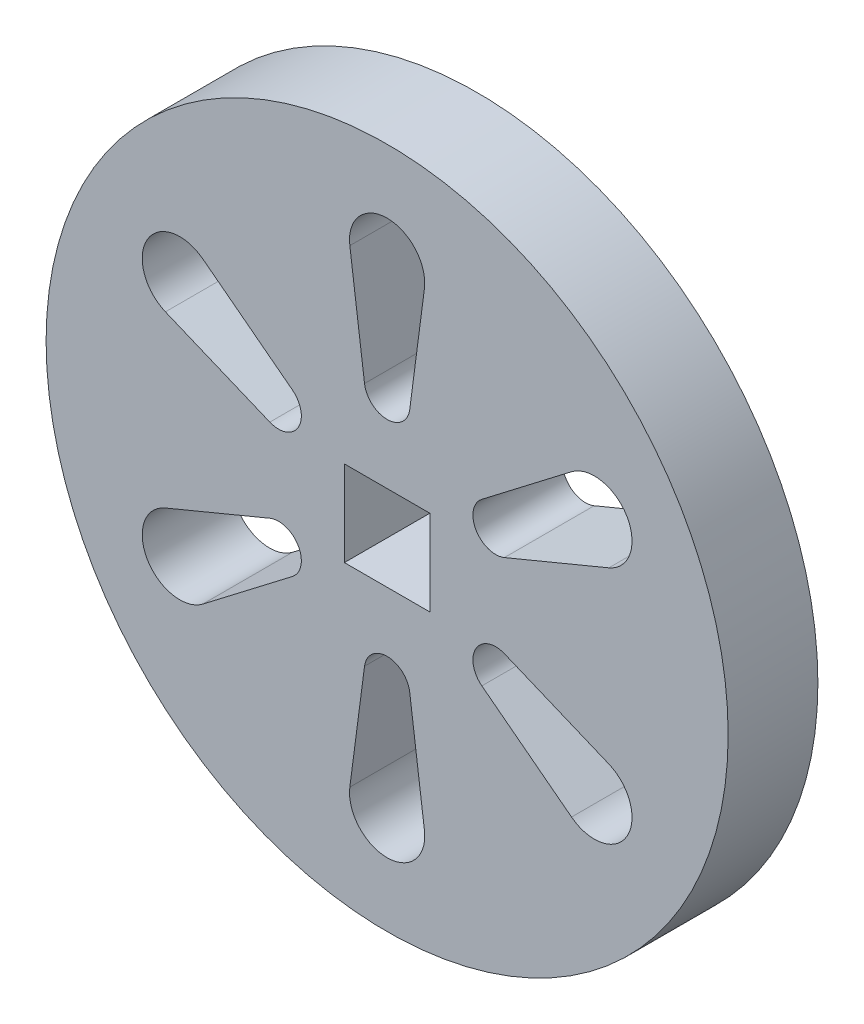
SolidWorks part; units mm, degrees
ref_plane "Front Plane" through (0, 0, 0) normal (0, 0, 1) x (1, 0, 0)
ref_plane "Top Plane" through (0, 0, 0) normal (0, 1, 0) x (1, 0, 0)
ref_plane "Right Plane" through (0, 0, 0) normal (1, 0, 0) x (0, 0, -1)
sketch "Sketch1" plane through (0, 0, 0) normal (0, 0, 1) x (1, 0, 0)
  circle A0 centre (0, 0) radius 38
  dimension "D1" = 76
extrude "Boss-Extrude1" add sketch "Sketch1" along normal blind 10
sketch "Sketch2" plane through (0, 0, 10) normal (0, 0, 1) x (1, 0, 0)
  circle A0 centre (0, 25.4) radius 3.9624
  dimension "D1" = 7.9248
  dimension "D2" = 25.4
extrude "Cut-Extrude1" [suppressed] cut sketch "Sketch2" against normal through all
pattern_circular "CirPattern1" [suppressed] count 6 over 360
sketch "Sketch3" plane through (0, 0, 10) normal (0, 0, 1) x (1, 0, 0)
  line L1 (-4.7625, 4.7625) -> (4.7625, 4.7625)
  line L2 (-4.7625, 4.7625) -> (-4.7625, -4.7625)
  line L3 (-4.7625, -4.7625) -> (4.7625, -4.7625)
  line L4 (4.7625, 4.7625) -> (4.7625, -4.7625)
  line L5 (-4.7625, 4.7625) -> (4.7625, -4.7625) construction
  line L6 (-4.7625, -4.7625) -> (4.7625, 4.7625) construction
  point P0 (0, 0)
  dimension "D1" = 9.525
  dimension "D2" = 9.525
extrude "Cut-Extrude2" cut sketch "Sketch3" against normal through all
sketch "Sketch4" plane through (0, 0, 10) normal (0, 0, 1) x (1, 0, 0)
  line L0 (-4.1554, 26.1252) -> (-2.5184, 13.6398)
  line L1 (4.1554, 26.1252) -> (2.5184, 13.6398)
  arc A2 (-4.1554, 26.1252) -> (4.1554, 26.1252) centre (0, 26.67) cw
  arc A3 (-2.5184, 13.6398) -> (2.5184, 13.6398) centre (0, 13.97) ccw
  dimension "D1" = 12.7
  dimension "D2" = 4.191
  dimension "D3" = 2.54
  dimension "D4" = 13.97
extrude "Cut-Extrude3" cut sketch "Sketch4" against normal through all contours L0 A3 L1 A2
pattern_circular "CirPattern2" count 6 over 360 about axis through (0, 0, 0) along (0, 0, 1) of "Cut-Extrude3"
